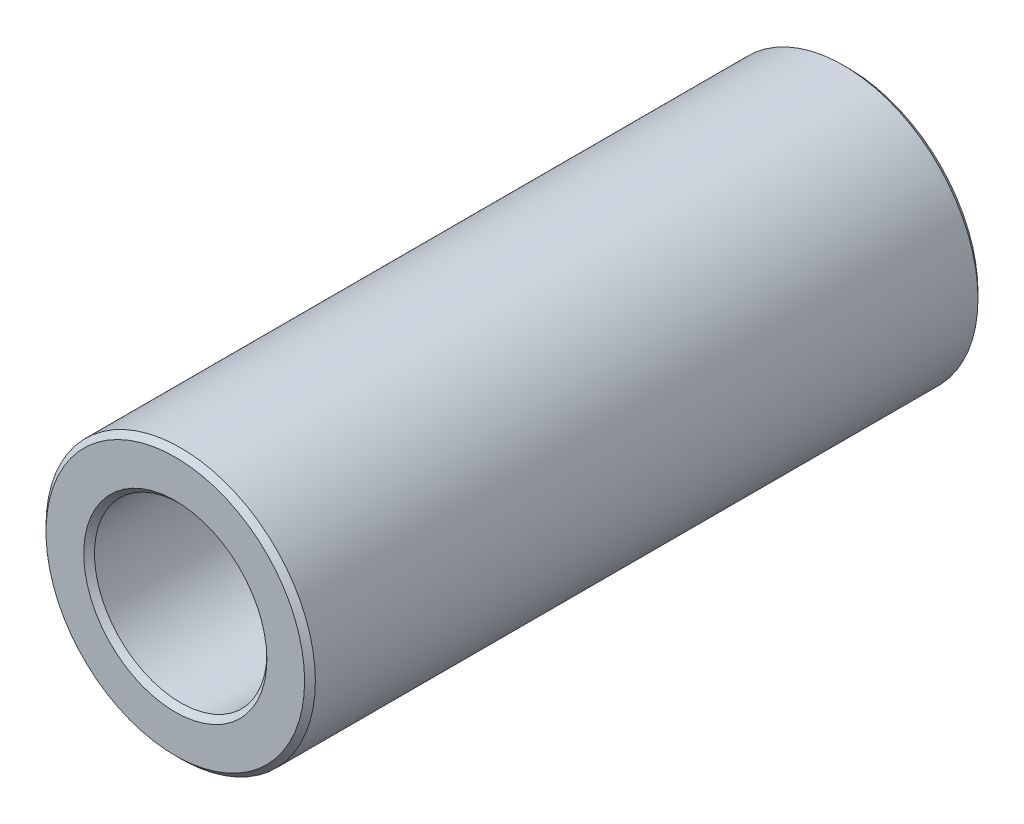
SolidWorks part; units mm, degrees
ref_plane "Front Plane" through (0, 0, 0) normal (0, 0, 1) x (1, 0, 0)
ref_plane "Top Plane" through (0, 0, 0) normal (0, 1, 0) x (1, 0, 0)
ref_plane "Right Plane" through (0, 0, 0) normal (1, 0, 0) x (0, 0, -1)
sketch "Sketch1" plane through (0, 0, 0) normal (0, 0, 1) x (1, 0, 0)
  circle A0 centre (0, 0) radius 5
  circle A1 centre (0, 0) radius 3.2
  dimension "D1" = 10
  dimension "D2" = 6.4
extrude "Boss-Extrude2" add sketch "Sketch1" along normal mid plane 25
chamfer "Chamfer3" distance 0.2 angle 45 4 edges at (5, 0, 12.5) (5, 0, -12.5) (3.2, 0, -12.5) (3.2, 0, 12.5)
